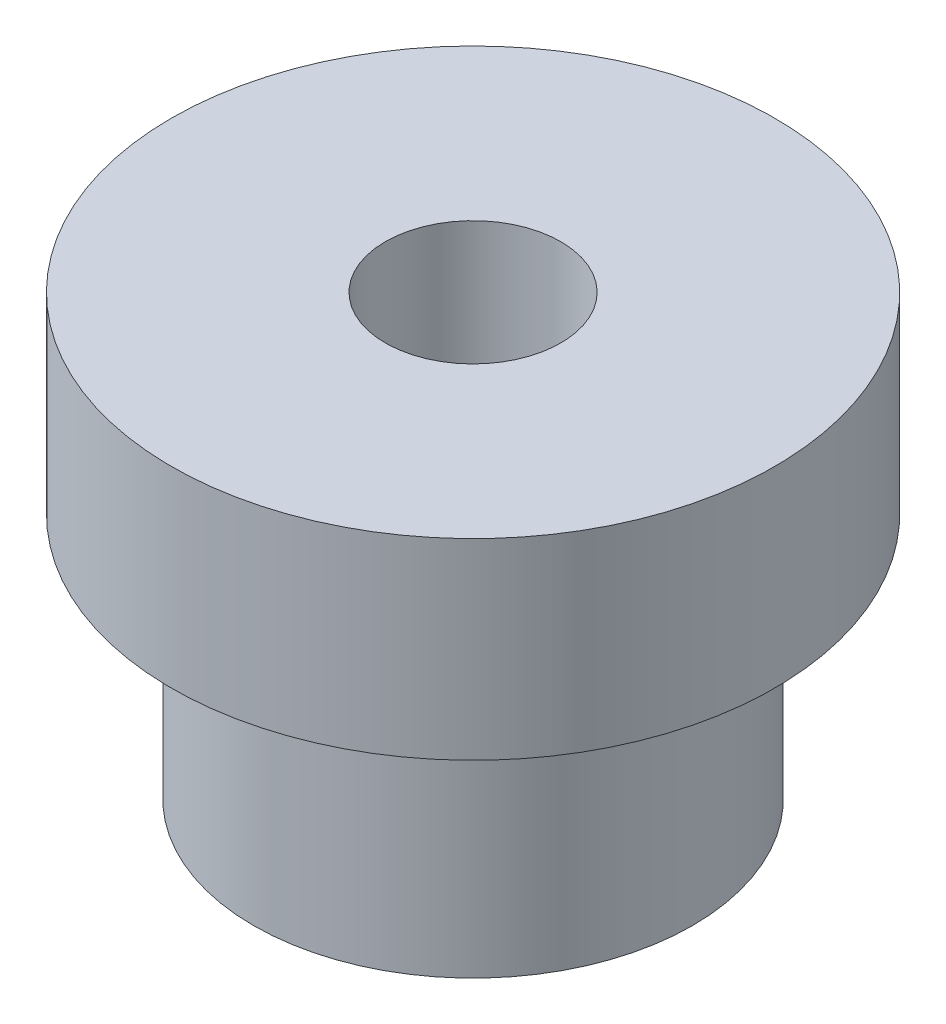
SolidWorks part; units mm, degrees
ref_plane "Plan1" through (0, 0, 0) normal (0, 0, 1) x (1, 0, 0)
ref_plane "Plan2" through (0, 0, 0) normal (0, 1, 0) x (1, 0, 0)
ref_plane "Plan3" through (0, 0, 0) normal (1, 0, 0) x (0, 0, -1)
sketch "Esquisse1" plane through (0, 0, 0) normal (0, 0, 1) x (1, 0, 0)
  line L0 (0, 2.6616) -> (0, -2.6616) construction
  line L1 (1.6, 3.5) -> (1.6, -4.5)
  line L2 (1.6, -4.5) -> (4, -4.5)
  line L3 (4, -4.5) -> (4, 0)
  line L4 (4, 0) -> (5.5, 0)
  line L5 (5.5, 0) -> (5.5, 3.5)
  line L6 (5.5, 3.5) -> (1.6, 3.5)
  dimension "D1" = 3.2
  dimension "D2" = 8
  dimension "D3" = 11
  dimension "D4" = 4.5
  dimension "D5" = 3.5
revolve "Base-Révolution" add sketch "Esquisse1" angle 360 about L0
